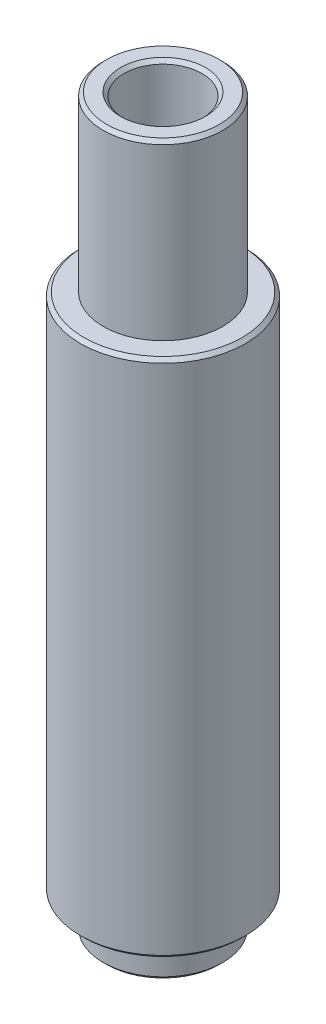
SolidWorks part; units mm, degrees
ref_plane "Front Plane" through (0, 0, 0) normal (0, 0, 1) x (1, 0, 0)
ref_plane "Top Plane" through (0, 0, 0) normal (0, 1, 0) x (1, 0, 0)
ref_plane "Right Plane" through (0, 0, 0) normal (1, 0, 0) x (0, 0, -1)
sketch "Sketch1" plane through (0, 0, 0) normal (0, 0, 1) x (1, 0, 0)
  line L0 (2.25, 0) -> (2.25, 42)
  line L1 (2.25, 42) -> (3.45, 42)
  line L2 (3.45, 42) -> (3.45, 32)
  line L3 (3.45, 32) -> (4.7625, 32)
  line L4 (4.7625, 32) -> (4.7625, 2)
  line L5 (4.7625, 2) -> (3.45, 2)
  line L6 (3.45, 2) -> (3.45, 0)
  line L7 (3.45, 0) -> (2.25, 0)
  line L8 (0, -1000) -> (0, 49000) construction
  point P14 (4.7625, 17)
  dimension "D1" = 6.9
  dimension "D2" = 40
  dimension "D3" = 9.525
  dimension "D4" = 2
  dimension "D5" = 10
  dimension "D6" = 4.5
revolve "Revolve1" add sketch "Sketch1" angle 360 about L8
chamfer "Chamfer1" distance 0.2 angle 45 6 edges at (4.7625, 2, 0) (3.45, 0, 0) (3.45, 42, 0) (4.7625, 32, 0) (2.25, 0, 0) (2.25, 42, 0)
